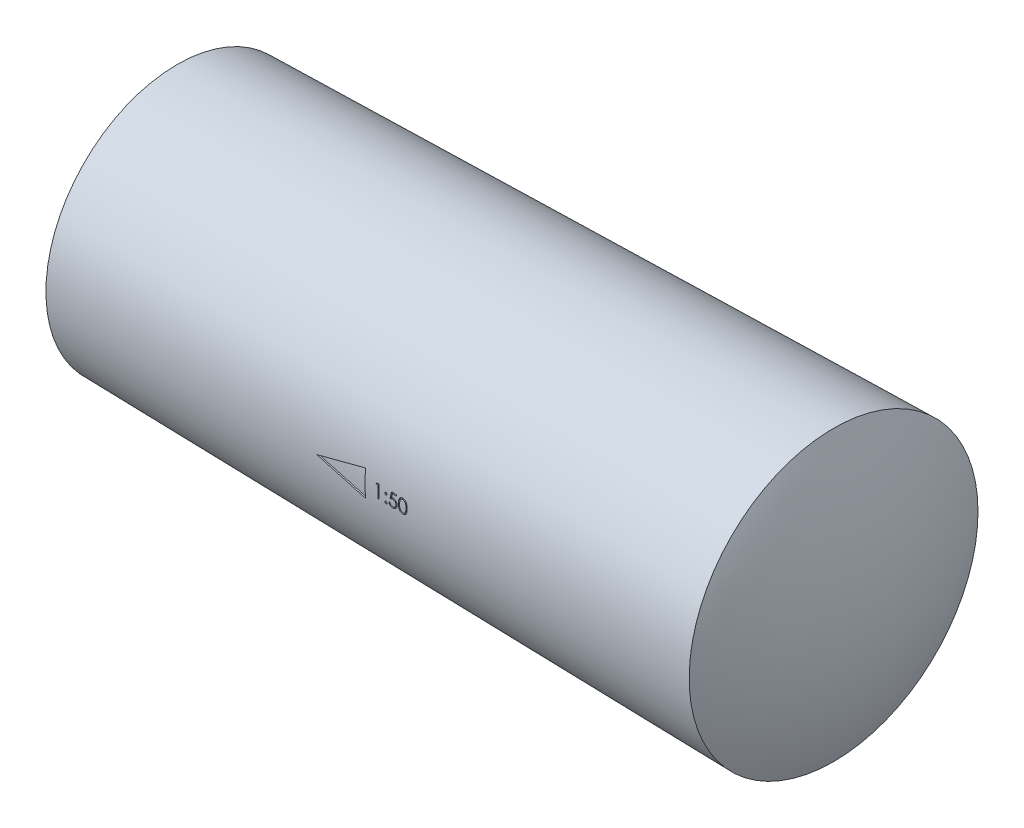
SolidWorks part; units mm, degrees
ref_plane "Front Plane" through (0, 0, 0) normal (0, 0, 1) x (1, 0, 0)
ref_plane "Top Plane" through (0, 0, 0) normal (0, 1, 0) x (1, 0, 0)
ref_plane "Right Plane" through (0, 0, 0) normal (1, 0, 0) x (0, 0, -1)
sketch "Sketch1" plane through (0, 0, 0) normal (1, 0, 0) x (0, 0, -1)
  circle A0 centre (0, 0) radius 10
  dimension "D1" = 20
extrude "Extrude1" add sketch "Sketch1" along normal mid plane 50
draft "Draft1" type of draft neutral plane draft angle 1.146 faces to draft 1 parameters "D1"=1.146
sketch "Sketch2" plane through (0, 0, 0) normal (0, 0, 1) x (1, 0, 0)
  line L0 (-25, 0) -> (-25, 10)
  line L1 (-25, 10) -> (-25, -10) construction
  line L2 (-25, 0) -> (-27.5, 0)
  line L3 (-27.5, 0) -> (-27.5, -10.5) construction
  line L4 (25, 0) -> (25, 11)
  line L5 (25, -11) -> (25, 11) construction
  line L6 (25, 0) -> (27.5, 0)
  line L7 (27.5, 0) -> (27.5, -10.5) construction
  line L8 (-25, -10) -> (25, -11) construction
  arc A0 (-27.5, 0) -> (-25, 10) centre (-6.25, 0) cw
  arc A1 (27.5, 0) -> (25, 11) centre (2.0499, 0) ccw
  point P14 (0, -10.5)
revolve "Revolve1" add sketch "Sketch2" angle 360 about L2
sketch "Sketch5" plane through (0, 0, 0) normal (0, 0, 1) x (1, 0, 0)
  line L0 (0, 10.5) -> (0, -10.5) construction
  line L1 (25, 11) -> (-25, 10) construction
  line L2 (-25, -10) -> (25, -11) construction
ref_plane "Plane2" through (0, 0, 0) normal (-0.02, 0, 0.9998) x (0.9998, 0, 0.02)
sketch "Sketch6" plane through (0, 0, 0) normal (-0.02, 0, 0.9998) x (0.9998, 0, 0.02)
  line L0 (0, 0) -> (0, 1)
  line L1 (0, 10.5) -> (0, -10.5) construction
  line L2 (0, 1) -> (-3.7321, 0)
  line L3 (-3.7321, 0) -> (0, -1)
  line L4 (0, -1) -> (0, 0)
  line L5 (0, -0.5) -> (4, -0.5) construction
  text T0 "1:50" font "Century Gothic" height 1
  dimension "D1" = 2
  dimension "D2" = 30
  dimension "D3" = 4
wrap "Wrap2" sketch "Sketch6" wrap type deboss source sketch "Sketch6" thickness 0.1 parameters "D1"=0.1
equation "\"D2@Sketch2\" = \"D1@Sketch2\""
